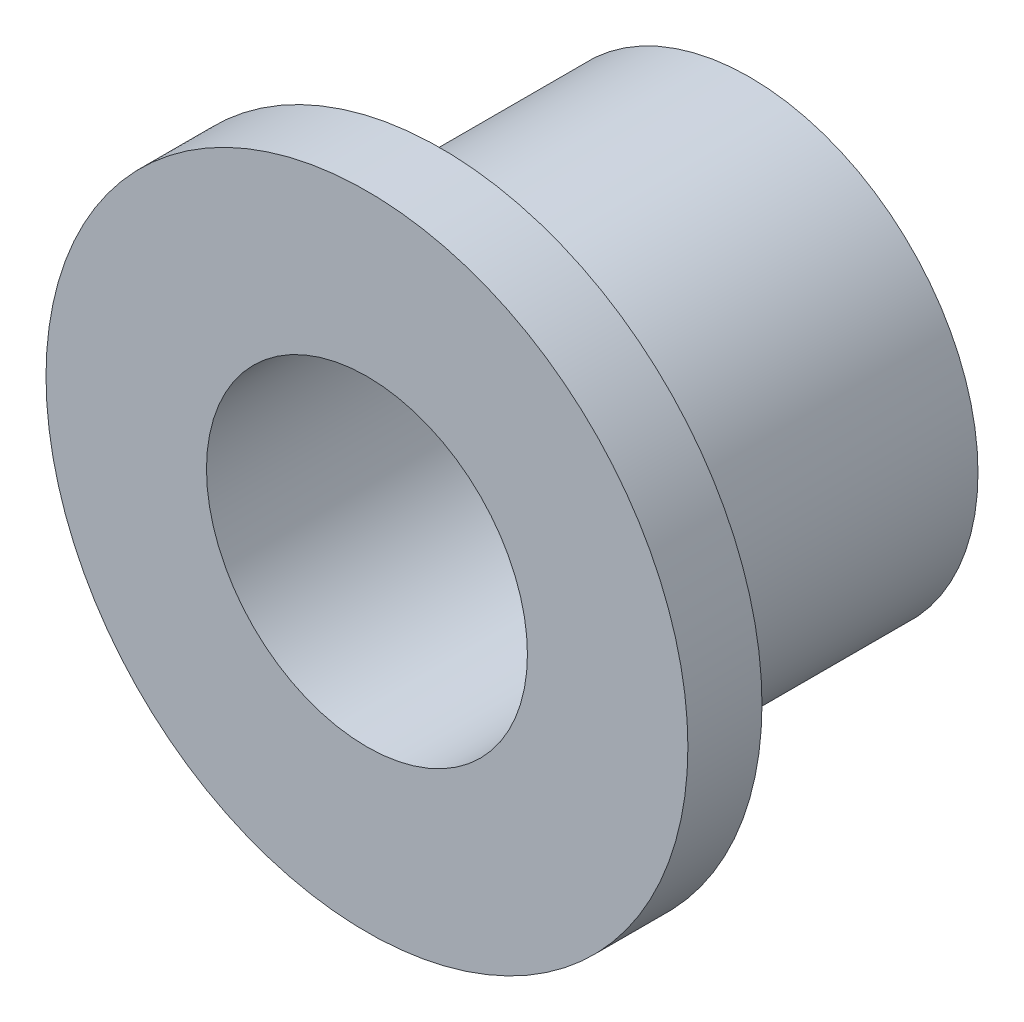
SolidWorks part; units mm, degrees
ref_plane "Front Plane" through (0, 0, 0) normal (0, 0, 1) x (1, 0, 0)
ref_plane "Top Plane" through (0, 0, 0) normal (0, 1, 0) x (1, 0, 0)
ref_plane "Right Plane" through (0, 0, 0) normal (1, 0, 0) x (0, 0, -1)
sketch "Sketch1" plane through (0, 0, 0) normal (0, 0, 1) x (1, 0, 0)
  circle A0 centre (0, 0) radius 6.604
  dimension "D1" = 13.208
extrude "Boss-Extrude1" add sketch "Sketch1" along normal blind 1.524
sketch "Sketch2" plane through (0, 0, 0) normal (0, 0, -1) x (-1, 0, 0)
  circle A0 centre (0, 0) radius 4.699
  dimension "D1" = 9.398
extrude "Boss-Extrude2" add sketch "Sketch2" along normal blind 6.35
sketch "Sketch3" plane through (0, 0, 1.524) normal (0, 0, 1) x (1, 0, 0)
  circle A0 centre (0, 0) radius 3.302
  dimension "D1" = 6.604
extrude "Cut-Extrude1" cut sketch "Sketch3" against normal through all
